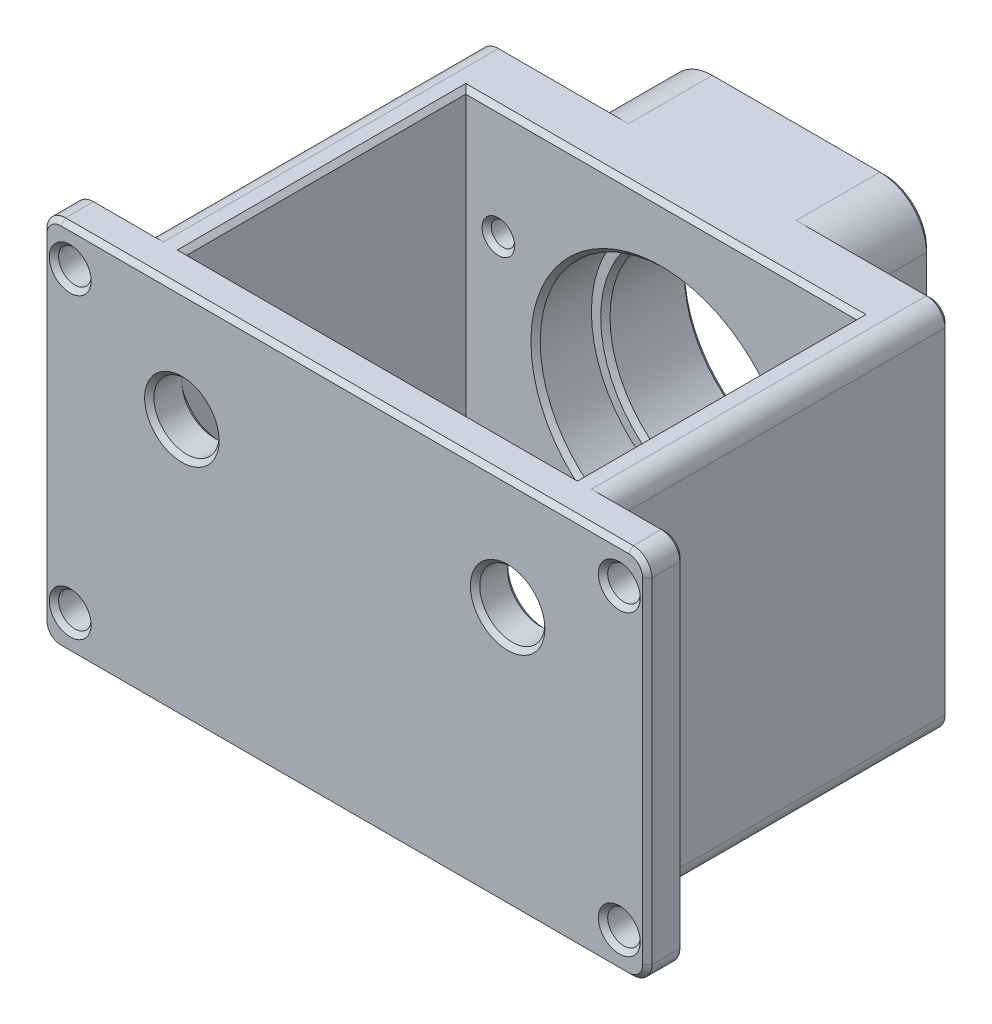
SolidWorks part; units mm, degrees
ref_plane "前视" through (0, 0, 0) normal (0, 0, 1) x (1, 0, 0)
ref_plane "上视" through (0, 0, 0) normal (0, 1, 0) x (1, 0, 0)
ref_plane "右视" through (0, 0, 0) normal (1, 0, 0) x (0, 0, -1)
sketch "草图1" plane through (0, 0, 0) normal (0, 0, 1) x (1, 0, 0)
  line L0 (0, 0) -> (0, 30.2327) construction
  line L1 (-25, -20) -> (25, -20)
  line L2 (-25, -20) -> (-25, 20)
  line L3 (-25, 20) -> (25, 20)
  line L4 (25, -20) -> (25, 20)
  line L5 (-25, -20) -> (25, 20) construction
  line L6 (-25, 20) -> (25, -20) construction
  line L7 (-25, 0) -> (25, 0) construction
  circle A0 centre (0, 0) radius 12
  circle A1 centre (-17.5, 8) radius 1.25
  circle A2 centre (17.5, 8) radius 1.25
  dimension "D1" = 40
  dimension "D3" = 24
  dimension "D4" = 35
  dimension "D5" = 2.5
  dimension "D6" = 8
  dimension "D2" = 50
extrude "凸台-拉伸1" add sketch "草图1" along normal blind 15
sketch "草图2" plane through (0, 0, 15) normal (0, 0, 1) x (1, 0, 0)
  line L0 (-25, -20) -> (25, -20) construction
  line L1 (-25, 20) -> (-21, 20)
  line L2 (-25, 20) -> (-25, -20)
  line L3 (-25, -20) -> (-21, -20)
  line L4 (-21, 20) -> (-21, -20)
  line L5 (0, 0) -> (0, 27.0284) construction
  line L6 (21, 20) -> (21, -20)
  line L7 (25, -20) -> (21, -20)
  line L8 (25, 20) -> (25, -20)
  line L9 (25, 20) -> (21, 20)
  dimension "D1" = 4
extrude "凸台-拉伸2" add sketch "草图2" along normal blind 30
sketch "草图3" plane through (0, 0, 45) normal (0, 0, 1) x (1, 0, 0)
  line L0 (-21, 20) -> (-25, 20) construction
  line L1 (-32.5, 20) -> (32.5, 20)
  line L2 (-32.5, 20) -> (-32.5, -20)
  line L3 (-32.5, -20) -> (32.5, -20)
  line L4 (32.5, 20) -> (32.5, -20)
  line L5 (21, -20) -> (25, -20) construction
  line L6 (0, 0) -> (0, 25.4704) construction
  line L7 (0, 0) -> (-35.1994, 0) construction
  circle A0 centre (-29.5, 16) radius 1.75
  circle A1 centre (29.5, 16) radius 1.75
  circle A2 centre (29.5, -16) radius 1.75
  circle A3 centre (-29.5, -16) radius 1.75
  circle A4 centre (-17.5, 8) radius 3.5
  circle A5 centre (17.5, 8) radius 3.5
  dimension "D2" = 3.5
  dimension "D3" = 3
  dimension "D4" = 59
  dimension "D5" = 4
  dimension "D6" = 32
  dimension "D7" = 7
  dimension "D1" = 65
extrude "凸台-拉伸3" add sketch "草图3" along normal blind 4
sketch "草图4" plane through (0, 0, 15) normal (0, 0, 1) x (1, 0, 0)
  circle A0 centre (0, 0) radius 13.5
  dimension "D1" = 27
extrude "切除-拉伸1" cut sketch "草图4" against normal offset from surface (6 mm away) 9
sketch "草图5" plane through (0, 20, 0) normal (0, 1, 0) x (1, 0, 0)
  line L0 (0, 0) -> (0, -19.2179) construction
  line L1 (25, 0) -> (-25, 0) construction
  line L2 (14, 0) -> (14, -9)
  line L3 (-25, 0) -> (-14, 0)
  line L4 (-25, 0) -> (-25, -9)
  line L5 (-25, -9) -> (-14, -9)
  line L6 (-14, 0) -> (-14, -9)
  line L7 (25, -9) -> (14, -9)
  line L8 (25, 0) -> (25, -9)
  line L9 (25, 0) -> (14, 0)
  dimension "D1" = 28
  dimension "D2" = 9
extrude "切除-拉伸2" cut sketch "草图5" against normal through all
fillet "圆角2" radius 5 4 edges at (-14, -20, 4.5) (14, -20, 4.5) (14, 20, 4.5) (-14, 20, 4.5)
fillet "圆角1" radius 2 8 edges at (-25, 20, 27) (-25, -20, 27) (25, -20, 27) (25, 20, 27) (-32.5, 20, 47) (-32.5, -20, 47) (32.5, 20, 47) (32.5, -20, 47)
chamfer "倒角1" distance 0.5 angle 45 59 edges at (-31.25, -16, 49) (27.75, 16, 49) (31.9142, 19.4142, 49) (32.5, 0, 49) (31.9142, -19.4142, 49) (0, -20, 49) (-31.9142, -19.4142, 49) (-32.5, 0, 49) (-31.9142, 19.4142, 49) (0, 20, 49) (-27.75, 16, 49) (31.25, -16, 49) (0, -20, 0) (0, 20, 0) (12, 0, 0) (26.75, -20, 45) (31.9142, -19.4142, 45) (32.5, 0, 45) (31.9142, 19.4142, 45) (26.75, 20, 45) (-26.75, 20, 45) (-31.9142, 19.4142, 45) (-32.5, 0, 45) (-31.9142, -19.4142, 45) (-26.75, -20, 45) (0, 20, 45) (0, -20, 45) (-21, -20, 30) (21, -20, 30) (0, -20, 15) (0, 20, 15) (16.25, 8, 15) (-16.25, 8, 15) (18.75, 8, 9) (-16.25, 8, 9) (12.5355, -18.5355, 0) (14, 0, 0) (12.5355, 18.5355, 0) (-12.5355, 18.5355, 0) (-14, 0, 0) (-12.5355, -18.5355, 0) (-12, 0, 9) (16, 20, 9) (24.4142, 19.4142, 9) (25, 0, 9) (24.4142, -19.4142, 9) (16, -20, 9) (-16, -20, 9) (-24.4142, -19.4142, 9) (-25, 0, 9) (-24.4142, 19.4142, 9) (-16, 20, 9) (13.5, 0, 15) (14, 8, 49) (-14, 8, 49) (14, 8, 45) (-14, 8, 45) (21, 20, 30) (-21, 20, 30)
